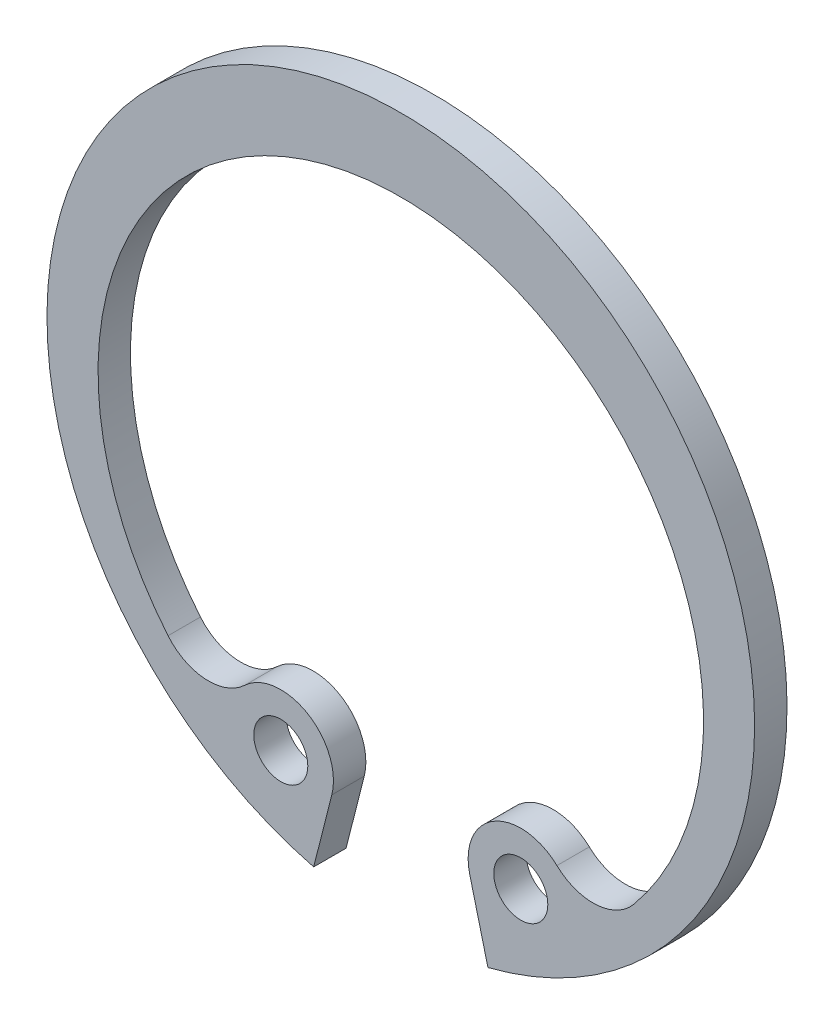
SolidWorks part; units mm, degrees
ref_plane "Plane1" through (0, 0, 0) normal (0, 0, 1) x (1, 0, 0)
ref_plane "Plane2" through (0, 0, 0) normal (0, 1, 0) x (1, 0, 0)
ref_plane "Plane3" through (0, 0, 0) normal (1, 0, 0) x (0, 0, -1)
sketch "Clipboard" plane through (0, 0, 0) normal (0, 0, 1) x (1, 0, 0)
  line L0 (0, 0) -> (2.7, 0)
  line L1 (0, 0) -> (0, 1.35)
  line L2 (0, 0) -> (0, -4.5)
  circle A0 centre (0, 0) radius 1
  circle A1 centre (0, 0) radius 12.5
  dimension "HoleDia" = 2
  dimension "BoreDia" = 25
  dimension "LargeSection" = 2.7
  dimension "SmallSection" = 1.35
  dimension "LugSection" = 4.5
sketch "BodySke" plane through (0, 0, 0) normal (0, 0, 1) x (1, 0, 0)
  line L0 (-1.5431, 0) -> (1.5431, 0) construction
  line L1 (0, 0) -> (0, 10.4) construction
  line L2 (3.2259, -12.6966) -> (2.5532, -10.0489)
  line L3 (-3.2259, -12.6966) -> (-2.5532, -10.0489)
  line L4 (0, 0) -> (9.5185, -9.0005) construction
  line L5 (0, 0) -> (-9.5185, -9.0005) construction
  line L6 (-4.1969, -8.5996) -> (-4.6894, -10.538) construction
  line L7 (4.2583, -8.8413) -> (4.628, -10.2962) construction
  arc A0 (-2.5532, -10.0489) -> (-5.7807, -8.1498) centre (-4.4431, -9.5688) ccw
  arc A1 (5.7807, -8.1498) -> (2.5532, -10.0489) centre (4.4431, -9.5688) ccw
  arc A2 (8.5376, -8.0729) -> (-8.5376, -8.0729) centre (0, -0.8094) ccw construction
  arc A3 (3.2259, -12.6966) -> (-3.2259, -12.6966) centre (0, 0) ccw
  circle A4 centre (4.4431, -9.5688) radius 1
  circle A5 centre (-4.4431, -9.5688) radius 1
  circle A6 centre (4.4431, -9.5688) radius 1.95 construction
  arc A7 (8.6174, -7.978) -> (-8.6174, -7.978) centre (0, -0.8094) ccw
  arc A8 (-4.4431, -9.5688) -> (4.4431, -9.5688) centre (0, 0) ccw construction
  arc A9 (-8.6174, -7.978) -> (-5.7807, -8.1498) centre (-7.1183, -6.7309) ccw
  arc A10 (5.7807, -8.1498) -> (8.6174, -7.978) centre (7.1183, -6.7309) ccw
  dimension "GrooveDia" = 26.2
  dimension "TipRad" = 1.95
  dimension "HoleOffsetRad" = 10.55
  dimension "HoleDia" = 2
  dimension "FilletRad" = 1.95
  dimension "LargeRad" = 10.4
  dimension "SmallRad" = 11.75
  dimension "SmallAngle" = 93.205
  dimension "GapAngle" = 28.511
extrude "Body" add sketch "BodySke" against normal blind 1.2
sketch "ModLugSke" plane through (0, 0, 0) normal (0, 0, 1) x (1, 0, 0)
  line L0 (3.2259, -12.6966) -> (2.1422, -8.4315)
  line L1 (-3.2259, -12.6966) -> (-2.1422, -8.4315)
  line L2 (7.1102, -4.8379) -> (10.8306, -7.3694) construction
  line L3 (-7.1102, -4.8379) -> (-10.8306, -7.3694) construction
  line L4 (-3.2259, -12.6966) -> (-2.5532, -10.0489) construction
  line L5 (2.5532, -10.0489) -> (3.2259, -12.6966) construction
  line L6 (0, 0) -> (0, -18.0732) construction
  line L7 (9.6212, -6.5465) -> (10.8306, -7.3694)
  line L8 (-10.8306, -7.3694) -> (-9.6212, -6.5465)
  arc A0 (3.2259, -12.6966) -> (10.8306, -7.3694) centre (0, 0) ccw
  arc A1 (-4.9183, -7.0548) -> (-2.2134, -8.3103) centre (0, 0) ccw
  arc A2 (3.2259, -12.6966) -> (-3.2259, -12.6966) centre (0, 0) ccw construction
  arc A3 (5.7807, -8.1498) -> (2.5532, -10.0489) centre (4.4431, -9.5688) ccw construction
  arc A4 (-4.9183, -7.0548) -> (-5.0435, -7.0636) centre (-4.9754, -7.1369) ccw
  arc A5 (-9.6212, -6.5465) -> (-5.0435, -7.0636) centre (-7.1102, -4.8379) ccw
  arc A6 (8.6174, -7.978) -> (-8.6174, -7.978) centre (0, -0.8094) ccw construction
  arc A7 (5.0435, -7.0636) -> (9.6212, -6.5465) centre (7.1102, -4.8379) ccw
  arc A8 (2.2134, -8.3103) -> (4.9183, -7.0548) centre (0, 0) ccw
  arc A9 (-10.8306, -7.3694) -> (-3.2259, -12.6966) centre (0, 0) ccw
  circle A10 centre (-4.4431, -9.5688) radius 1
  circle A11 centre (-4.4431, -9.5688) radius 1 construction
  circle A12 centre (4.4431, -9.5688) radius 1
  circle A13 centre (4.4431, -9.5688) radius 1 construction
  arc A14 (-2.2134, -8.3103) -> (-2.1422, -8.4315) centre (-2.2392, -8.4069) cw
  arc A15 (2.2134, -8.3103) -> (2.1422, -8.4315) centre (2.2392, -8.4069) ccw
  arc A16 (4.9183, -7.0548) -> (5.0435, -7.0636) centre (4.9754, -7.1369) cw
  point P43 (2.1178, -8.3352)
  dimension "D1" = 0.1
  dimension "LugAng" = 69.764
extrude "ModLug" [suppressed] add sketch "ModLugSke" against normal through all
sketch "UnlSke" [suppressed] plane through (0, 0, 0) normal (0, 0, 1) x (1, 0, 0)
  line L0 (2.1178, -8.3352) -> (3.2259, -12.6966)
  line L1 (-2.1178, -8.3352) -> (-3.2259, -12.6966)
  line L2 (-3.2259, -12.6966) -> (-2.1422, -8.4315) construction
  line L3 (2.1422, -8.4315) -> (3.2259, -12.6966) construction
  arc A0 (2.1178, -8.3352) -> (-2.1178, -8.3352) centre (0, 0) ccw
  arc A1 (3.2259, -12.6966) -> (-3.2259, -12.6966) centre (0, 0) ccw
  arc A2 (3.2259, -12.6966) -> (-3.2259, -12.6966) centre (0, 0) ccw construction
  circle A4 centre (-4.4431, -9.5688) radius 1
  circle A5 centre (4.4431, -9.5688) radius 1
  circle A6 centre (4.4431, -9.5688) radius 1 construction
  circle A7 centre (-4.4431, -9.5688) radius 1 construction
  arc A8 (2.2134, -8.3103) -> (4.9183, -7.0548) centre (0, 0) ccw construction
extrude "Unlug" [suppressed] add sketch "UnlSke" against normal through all
equation "' \"BoreDia@Clipboard\" = 8"
equation "' \"Thickness@Body\" = 0.8"
equation "' \"GrooveDia@BodySke\" = 8.4"
equation "' \"LugSection@Clipboard\" = 2.4"
equation "' \"LargeSection@Clipboard\" = 1.1"
equation "' \"HoleDia@Clipboard\" = 1.0"
equation "' \"BoreDia@Clipboard\" = 25"
equation "' \"Thickness@Body\" = 1.2"
equation "' \"GrooveDia@BodySke\" = 26.2"
equation "' \"LugSection@Clipboard\" = 4.5"
equation "' \"LargeSection@Clipboard\" = 2.7"
equation "' \"HoleDia@Clipboard\" = 2"
equation "\"SmallSection@Clipboard\" = \"LargeSection@Clipboard\" * 0.5"
equation "\"TipRad@BodySke\" = (\"LugSection@Clipboard\" - (\"GrooveDia@BodySke\" / 2  -  \"BoreDia@Clipboard\" / 2 ) ) / 2"
equation "\"HoleOffsetRad@BodySke\" = (\"GrooveDia@BodySke\" / 2) - \"LugSection@Clipboard\"  + \"TipRad@BodySke\""
equation "\"LargeRad@BodySke\" =  \"GrooveDia@BodySke\" / 2 -  \"LargeSection@Clipboard\""
equation "\"SmallRad@BodySke\" =  \"GrooveDia@BodySke\" / 2 -  \"SmallSection@Clipboard\""
equation "\"HoleDia@BodySke\" =  \"HoleDia@Clipboard\""
equation "\"FilletRad@BodySke\" = \"TipRad@BodySke\" * 1.0"
equation "\"GapAngle@BodySke\" = 360 - 0.965 * 360 * ( \"BoreDia@Clipboard\" /  \"GrooveDia@BodySke\")"
equation "\"LugAng@ModLugSke\" = \"GapAngle@BodySke\"  + 2 * 360 * (\"LugSection@Clipboard\" / (\"BoreDia@Clipboard\" * 3.1416))"
